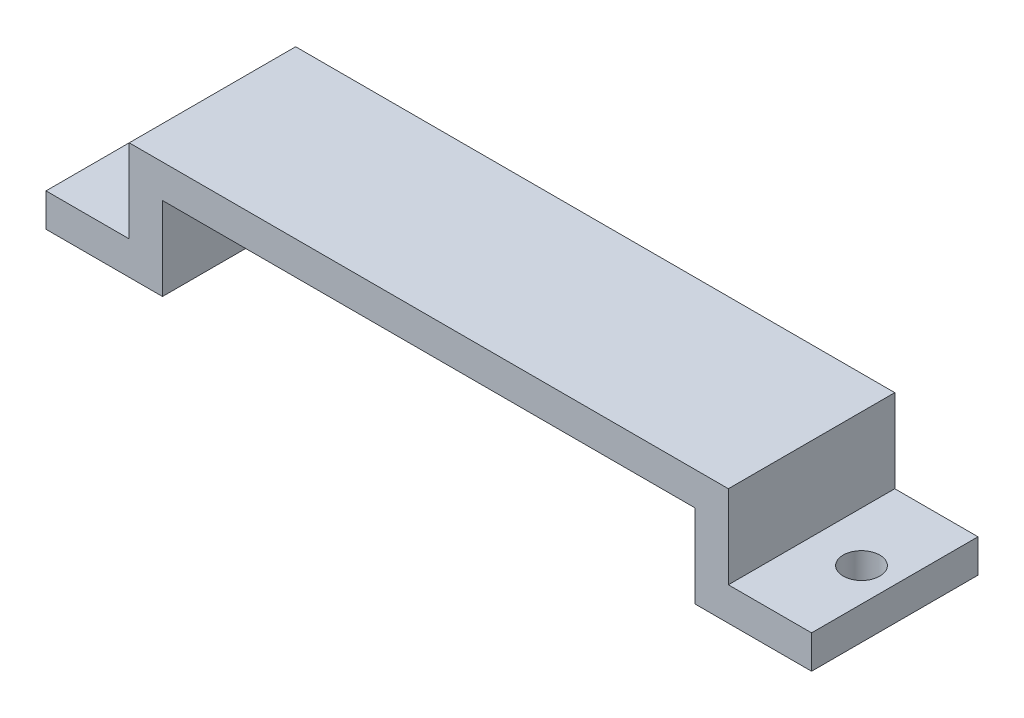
SolidWorks part; units mm, degrees
ref_plane "Ebene vorne" through (0, 0, 0) normal (0, 0, 1) x (1, 0, 0)
ref_plane "Ebene oben" through (0, 0, 0) normal (0, 1, 0) x (1, 0, 0)
ref_plane "Ebene rechts" through (0, 0, 0) normal (1, 0, 0) x (0, 0, -1)
sketch "Skizze2" plane through (0, 0, 0) normal (0, 0, 1) x (1, 0, 0)
  line L0 (-16, 0) -> (16, 0)
  line L1 (16, 0) -> (16, -5)
  line L2 (16, -5) -> (23, -5)
  line L3 (-16, 0) -> (-16, -5)
  line L4 (-16, -5) -> (-23, -5)
  line L5 (-18, -3) -> (-23, -3)
  line L6 (-18, 2) -> (-18, -3)
  line L7 (-18, 2) -> (18, 2)
  line L8 (18, 2) -> (18, -3)
  line L9 (18, -3) -> (23, -3)
  line L10 (-23, -3) -> (-23, -5)
  line L11 (23, -3) -> (23, -5)
  point P5 (0, 0)
  dimension "D1" = 32
  dimension "D2" = 5
  dimension "D3" = 5
  dimension "D4" = 7
  dimension "D5" = 7
  dimension "D6" = 2
extrude "Aufsatz-Linear austragen1" add sketch "Skizze2" along normal mid plane 10
sketch "Skizze3" plane through (0, -3, 0) normal (0, 1, 0) x (1, 0, 0)
  line L0 (0, -6.665) -> (0, 7.677) construction
  circle A0 centre (21, 0) radius 1.1
  circle A1 centre (-21, 0) radius 1.1
  dimension "D1" = 2.2
  dimension "D2" = 21
extrude "Schnitt-Linear austragen1" cut sketch "Skizze3" against normal through all
